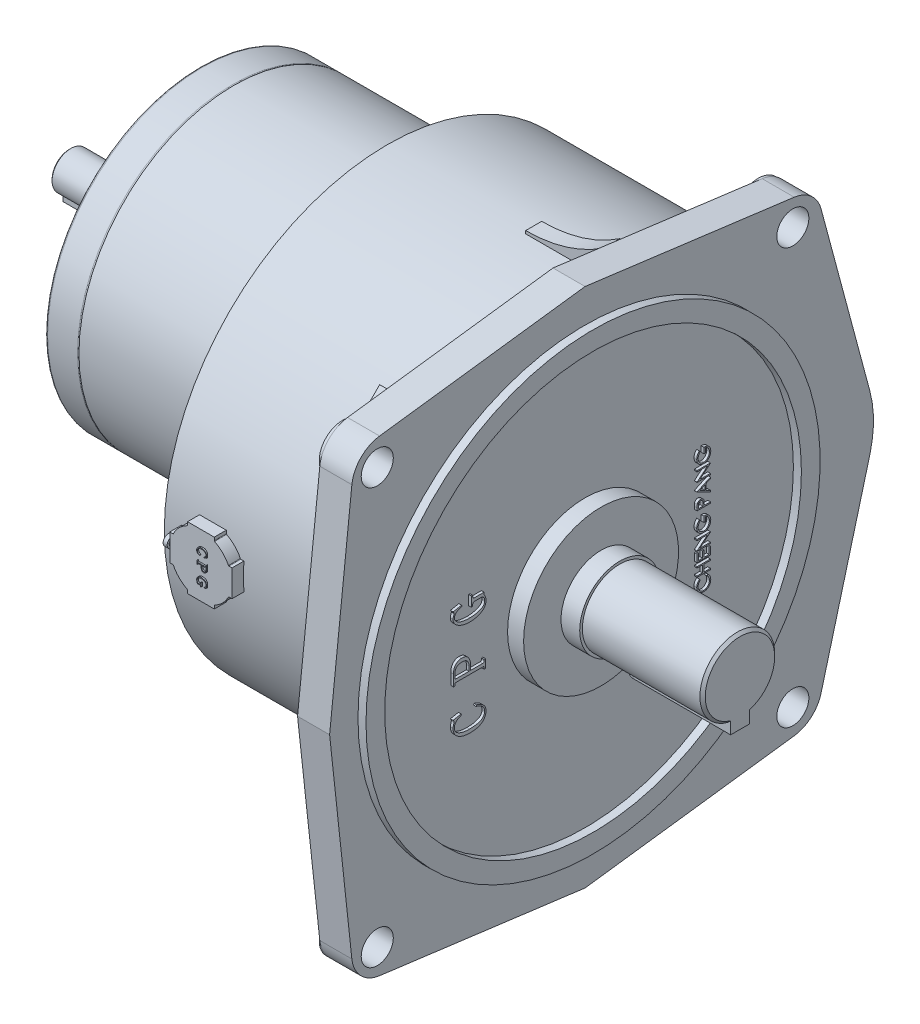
SolidWorks part; units mm, degrees
ref_plane "前视基准面" through (0, 0, 0) normal (0, 0, 1) x (1, 0, 0)
ref_plane "上视基准面" through (0, 0, 0) normal (0, 1, 0) x (1, 0, 0)
ref_plane "右视基准面" through (0, 0, 0) normal (1, 0, 0) x (0, 0, -1)
sketch "草图1" plane through (0, 0, 0) normal (0, 1, 0) x (1, 0, 0)
  line L0 (0, 0) -> (15.7361, 0) construction
  line L1 (0, 0) -> (0, -14)
  line L2 (0, -14) -> (-45, -14)
  line L3 (-45, -14) -> (-45, -15)
  line L4 (-45, -15) -> (-52, -15)
  line L5 (-55, -29) -> (-55, -85)
  line L6 (-55, -85) -> (-58, -85)
  line L7 (-58, -85) -> (-58, 0)
  line L8 (-58, 0) -> (0, 0)
  line L9 (-55, -29) -> (-52, -29)
  line L10 (-52, -29) -> (-52, -15)
  dimension "D1" = 45
  dimension "D2" = 28
  dimension "D3" = 30
  dimension "D4" = 3
  dimension "D5" = 170
  dimension "D6" = 58
  dimension "D7" = 3
  dimension "D8" = 58
revolve "旋转1" add sketch "草图1" angle 360 about L0
sketch "草图2" plane through (0, 0, 0) normal (0, 1, 0) x (1, 0, 0)
  line L0 (8.0167, 23) -> (-70, 23) construction
  line L1 (-58, 85) -> (-58, -85) construction
  line L4 (-70, 23) -> (-70, -60.5)
  line L5 (-70, -60.5) -> (-155, -60.5)
  line L6 (-155, -60.5) -> (-155, 23)
  line L11 (-70, 23) -> (-155, 23)
  dimension "D1" = 23
  dimension "D2" = 12
  dimension "D3" = 167
  dimension "D5" = 85
revolve "旋转2" add sketch "草图2" angle 360 about L0
sketch "草图12" plane through (-70, 0, 0) normal (1, 0, 0) x (0, 0, -1)
  line L0 (0, -97.5) -> (86.267, -86.267)
  line L1 (-86.267, -86.267) -> (0, -97.5)
  line L2 (-86.267, -86.267) -> (-95.6178, 0)
  line L3 (-86.267, 86.267) -> (0, 97.5)
  line L4 (86.267, -86.267) -> (109.3822, 0)
  line L5 (-95.6178, 0) -> (-86.267, 86.267)
  line L6 (0, 97.5) -> (86.267, 86.267)
  line L7 (109.3822, 0) -> (86.267, 86.267)
  line L8 (167.8979, 0) -> (-107.2143, 0) construction
  line L9 (0, 107.5085) -> (0, -103.3164) construction
  line L10 (0, 0) -> (-77.7817, 77.7817) construction
  line L11 (0, 0) -> (77.7817, 77.7817) construction
  circle A0 centre (0, 0) radius 110 construction
  circle A1 centre (-77.7817, 77.7817) radius 6
  circle A2 centre (77.7817, 77.7817) radius 6
  circle A3 centre (77.7817, -77.7817) radius 6
  circle A4 centre (-77.7817, -77.7817) radius 6
  dimension "D3" = 220
  dimension "D4" = 12
  dimension "D5" = 15
  dimension "D1" = 195
  dimension "D2" = 205
  dimension "D6" = 12
extrude "拉伸8" add sketch "草图12" along normal up to surface (12 mm away)
sketch "草图5" plane through (0, 0, 0) normal (0, 1, 0) x (1, 0, 0)
  line L0 (0, -3.5) -> (-36.5, -3.5)
  line L1 (0, -14) -> (0, 14) construction
  line L2 (-36.5, 3.5) -> (0, 3.5)
  line L3 (0, 3.5) -> (0, -3.5)
  line L4 (31.1, -13.7955) -> (31.1, 19.6443) construction
  arc A0 (-36.5, -3.5) -> (-36.5, 3.5) centre (-36.5, 0) cw
  dimension "D2" = 40
  dimension "D1" = 7
  dimension "D3" = 31.1
extrude "拉伸4" add sketch "草图5" against normal blind 17.1
fillet "圆角4" radius 12 4 edges at (-64, 86.267, 86.267) (-64, 86.267, -86.267) (-64, -86.267, -86.267) (-64, -86.267, 86.267)
fillet "圆角5" radius 40 1 edges at (-64, 0, -109.3822)
chamfer "倒角1" distance 1 angle 45 1 edges at (0, 14, 0)
sketch "草图18" plane through (-70, 0, 0) normal (-1, 0, 0) x (0, 0, 1)
  line L0 (-23, 0) -> (65.9169, -88.9169) construction
  line L1 (0, -85.25) -> (0, 85.25) construction
  line L2 (76.9039, -87.4862) -> (0, -97.5) construction
  line L3 (36.0434, -59.0434) -> (65.9169, -88.9169)
  line L4 (-23, 0) -> (-77.7817, -77.7817) construction
  line L5 (-76.7543, -75.4044) -> (-71.081, -68.2676)
  line L7 (-23, 0) -> (-23, -94.5051) construction
  line L8 (0, -97.5) -> (-78.3038, -87.3039) construction
  line L9 (-23, -83.5) -> (-23, -94.5051)
  circle A0 centre (-23, 0) radius 83.5 construction
  arc A1 (-88.3455, -78.5102) -> (-78.3038, -87.3039) centre (-76.7543, -75.4044) ccw construction
  circle A3 centre (-23, 0) radius 83.5 construction
  dimension "D1" = 45
  dimension "D2" = 9.117
  dimension "D4" = 42.2474
  dimension "D5" = 11.0051
ref_plane "基准面7" through (-71, 0, 0) normal (1, 0, 0) x (0, 0, -1)
sketch "草图13" plane through (-70, 0, 0) normal (1, 0, 0) x (0, 0, -1)
  line L5 (0, 0) -> (107.7406, 0) construction
  circle A1 centre (77.7817, 77.7817) radius 9.4101
  circle A3 centre (77.7817, 77.7817) radius 6
  circle A4 centre (77.7817, -77.7817) radius 6 construction
  circle A5 centre (77.7817, -77.7817) radius 6
  circle A7 centre (-77.7817, -77.7817) radius 6
  arc A10 (78.3038, -87.3039) -> (88.3455, -78.5102) centre (76.7543, -75.4044) ccw construction
  circle A11 centre (-77.7817, -77.7817) radius 6 construction
  arc A12 (-87.2845, -76.8798) -> (-76.9039, -87.4862) centre (-75.3544, -75.5867) ccw construction
  circle A14 centre (-77.7817, 77.7817) radius 6
  circle A15 centre (-77.7817, 77.7817) radius 8.7273
  circle A20 centre (-77.7817, -77.7817) radius 8.7273
  circle A21 centre (77.7817, -77.7817) radius 9.4101
  point P8 (23, 0)
extrude "拉伸9" add sketch "草图13" against normal up to surface (1 mm away)
sketch "草图14" plane through (0, 0, 0) normal (0, 1, 0) x (1, 0, 0)
  line L0 (-70, 23) -> (-155, 23) construction
  line L5 (-70, -76.9039) -> (-70, 0) construction
  line L6 (-100.2474, -60.5) -> (-100.2474, -61.5)
  line L7 (-70, -90.7474) -> (-71, -90.7474)
  line L9 (-70, -60.5) -> (-155, -60.5) construction
  arc A0 (-71, -90.7474) -> (-100.2474, -61.5) centre (-100.2474, -90.7474) ccw
  dimension "D1" = 113.7474
  dimension "D2" = 1
  dimension "D3" = 1
rib "筋17" sketch "草图14" sketch "草图14" thickness 6 extrusion direction parallel to sketch draft on no parameters "D1"=6
pattern_circular "阵列(圆周)16" count 8 over 360 about axis through (0, 0, -23) along (1, 0, 0) of "筋17"
ref_plane "基准面8" through (0, 0, -23) normal (0, 0, 1) x (1, 0, 0)
sketch "草图17" plane through (0, 0, -23) normal (0, 0, 1) x (1, 0, 0)
  line L0 (-70, -93.5051) -> (-71, -93.5051)
  line L1 (-70, -87.4862) -> (-70, -97.5) construction
  line L2 (-100.2474, -83.5) -> (-100.2474, -84.5)
  line L4 (-155, -83.5) -> (-70, -83.5) construction
  line L6 (-100.2474, -61.8718) -> (-100.2474, -57.6292) construction
  arc A0 (-71, -93.5051) -> (-100.2474, -84.5) centre (-100.2474, -136.4984) ccw
  dimension "D1" = 10.0051
  dimension "D2" = 1
  dimension "D3" = 1
rib "筋24" sketch "草图17" sketch "草图17" thickness 6 extrusion direction parallel to sketch draft on no parameters "D1"=6
mirror "镜向1" about plane through (0, 0, 0) normal (0, 1, 0) of "筋24"
sketch "草圖1" plane through (0, 0, 0) normal (0, 1, 0) x (1, 0, 0)
  line L0 (-274.7669, 39) -> (-14.3566, 39) construction
  line L2 (-228.456, -19) -> (-228.456, 39)
  line L3 (-228.456, 39) -> (-155, 39)
  line L4 (-155, -19) -> (-155, 39)
  line L5 (-228.456, -19) -> (-155, -19)
  dimension "D1" = 39
  dimension "D2" = 116
revolve "旋轉1" add sketch "草圖1" angle 360 about L0
sketch "草圖2" plane through (0, 0, 0) normal (0, 1, 0) x (1, 0, 0)
  line L0 (-266.5, 46) -> (-289.5, 46)
  line L1 (-289.5, 46) -> (-290, 45.5)
  line L2 (-290, 45.5) -> (-290, 39)
  line L3 (-263, 64.2) -> (-263, 46.25)
  line L4 (-265, 45.95) -> (-266.5, 45.95)
  line L5 (-265, 45.95) -> (-264.5, 46.25)
  line L6 (-264.5, 46.25) -> (-263, 46.25)
  line L7 (-228.956, 97) -> (-240.2, 97)
  line L8 (-254.3476, 65) -> (-262.2, 65)
  line L9 (-241.3797, 73.0851) -> (-253.7273, 65.2156)
  line L10 (-291.4147, 39) -> (-77.5909, 39) construction
  line L11 (-228.456, 96.5) -> (-228.456, 39)
  line L13 (-290, 39) -> (-228.456, 39)
  line L14 (-241, 96.2) -> (-241, 73.8695)
  line L15 (-266.5, 46) -> (-266.5, 45.95)
  arc A0 (-262.2, 65) -> (-263, 64.2) centre (-262.2, 64.2) ccw
  arc A3 (-254.3476, 65) -> (-253.7273, 65.2156) centre (-254.3476, 66) ccw
  arc A6 (-241.3797, 73.0851) -> (-241, 73.8695) centre (-242, 73.8695) ccw
  arc A7 (-240.2, 97) -> (-241, 96.2) centre (-240.2, 96.2) ccw
  arc A8 (-228.456, 96.5) -> (-228.956, 97) centre (-228.956, 96.5) ccw
  dimension "D1" = 39
  dimension "D2" = 116
  dimension "D3" = 14
  dimension "D4" = 25
  dimension "D5" = 290
revolve "旋轉2" add sketch "草圖2" angle 360 about L10
ref_plane "平面1" through (0, 0, -39) normal (0, 0, 1) x (1, 0, 0)
sketch "草圖3" plane through (0, 0, 0) normal (0, 1, 0) x (1, 0, 0)
  line L0 (-317.9373, 39) -> (-256.6094, 39) construction
  line L1 (-290, 36.5023) -> (-270.5, 36.5023)
  line L2 (-290, 45.5) -> (-290, 32.5) construction
  line L3 (-270.5, 41.5023) -> (-290, 41.5023)
  line L4 (-290, 41.5023) -> (-290, 36.5023)
  line L5 (-268, 39) -> (-268, 26.6999) construction
  line L6 (-306.2, 39) -> (-306.2, 10.3712) construction
  arc A0 (-270.5, 36.5023) -> (-270.5, 41.5023) centre (-270.5, 39.0023) ccw
  dimension "D1" = 7
  dimension "D2" = 5
  dimension "D3" = 2.5023
  dimension "D4" = 22
  dimension "D5" = 16.2
extrude "伸長1" add sketch "草圖3" against normal blind 9.2
sketch "草圖4" plane through (-55, 0, 0) normal (1, 0, 0) x (0, 0, -1)
  circle A0 centre (0, 0) radius 78
  circle A1 centre (0, 0) radius 29 construction
  circle A2 centre (0, 0) radius 29
  dimension "D1" = 156
extrude "伸長2" cut sketch "草圖4" against normal blind 3
sketch "草圖5"
  dimension "D1" = 80
  dimension "D2" = 80
extrude "伸長3" add sketch "草圖5" along normal blind 1
ref_plane "平面2" through (0, 0, 64.8) normal (0, 0, 1) x (1, 0, 0)
sketch "草圖6" plane through (0, 0, 64.8) normal (0, 0, 1) x (1, 0, 0)
  line L0 (-142, 11.65) -> (-132, 11.65)
  line L1 (-142, 11.65) -> (-142, 10.5119)
  line L2 (-132, 11.65) -> (-132, 10.5119)
  line L3 (-142, -10.5119) -> (-142, -11.65)
  line L4 (-132, -10.5119) -> (-132, -11.65)
  line L5 (-148.65, 5) -> (-147.5119, 5)
  line L6 (-148.65, -5) -> (-147.5119, -5)
  line L7 (-148.65, -5) -> (-148.65, 5)
  line L8 (-142, -11.65) -> (-142, -10.5119)
  line L9 (-132, -11.65) -> (-132, -10.5119)
  line L10 (-132, -11.65) -> (-142, -11.65)
  line L11 (-125.35, -5) -> (-126.4881, -5)
  line L12 (-125.35, 5) -> (-126.4881, 5)
  line L13 (-125.35, 5) -> (-125.35, -5)
  arc A0 (-142.1383, 10.2882) -> (-147.2882, 5.1383) centre (-137, 0) ccw
  arc A1 (-142.1383, 10.2882) -> (-142, 10.5119) centre (-142.25, 10.5119) ccw
  arc A2 (-132, 10.5119) -> (-131.8617, 10.2882) centre (-131.75, 10.5119) ccw
  arc A3 (-147.5119, 5) -> (-147.2882, 5.1383) centre (-147.5119, 5.25) ccw
  arc A4 (-147.2882, -5.1383) -> (-147.5119, -5) centre (-147.5119, -5.25) ccw
  arc A5 (-142, -10.5119) -> (-142.1383, -10.2882) centre (-142.25, -10.5119) ccw
  arc A6 (-131.8617, -10.2882) -> (-132, -10.5119) centre (-131.75, -10.5119) ccw
  arc A7 (-126.4881, -5) -> (-126.7118, -5.1383) centre (-126.4881, -5.25) ccw
  arc A8 (-126.7118, 5.1383) -> (-126.4881, 5) centre (-126.4881, 5.25) ccw
  arc A9 (-126.7118, 5.1383) -> (-131.8617, 10.2882) centre (-137, 0) ccw
  arc A10 (-147.2882, -5.1383) -> (-142.1383, -10.2882) centre (-137, 0) ccw
  arc A11 (-131.8617, -10.2882) -> (-126.7118, -5.1383) centre (-137, 0) ccw
extrude "伸長4" add sketch "草圖6" against normal blind 4.5 contours A6 A11 A7 L11 L13 L12 A8 A9 A2 L2 L0 L1 A1 A0 A3 L5 L7 L6 A4 A10 A5 L3 L10 L4
sketch "草圖7"
extrude "伸長5" add sketch "草圖7" along normal blind 0.5
sketch "草圖8" plane through (0, 0, 0) normal (0, 1, 0) x (1, 0, 0)
  line L0 (-151.377, -62.55) -> (-143.377, -62.55)
  line L1 (-151.377, -62.55) -> (-151.377, -60.55)
  line L2 (-149.877, -61.3) -> (-149.877, -60.55)
  line L4 (-107.25, -64.8) -> (107.25, -64.8) construction
  line L13 (-147.877, -61.3) -> (-143.377, -61.55)
  line L15 (-149.877, -61.3) -> (-147.877, -61.3)
  line L23 (-151.377, -60.55) -> (-149.877, -60.55)
  line L24 (-147.877, -62.55) -> (-147.877, -61.3)
  line L25 (-143.377, -62.55) -> (-143.377, -61.55)
  dimension "D1" = 2.25
revolve "旋轉3" add sketch "草圖8" angle 360 about L0
equation "\"D3@草图1\" = \"D2@草图1\"+2"
equation "\"D5@草图1\" = \"D1@草圖4\"+14"
equation "\"D1@拉伸4\" = \"D3@草图5\"-\"D2@草图1\"/2"
equation "\"D1@伸長1\" = \"D5@草圖3\"-\"D3@草圖2\"/2"
